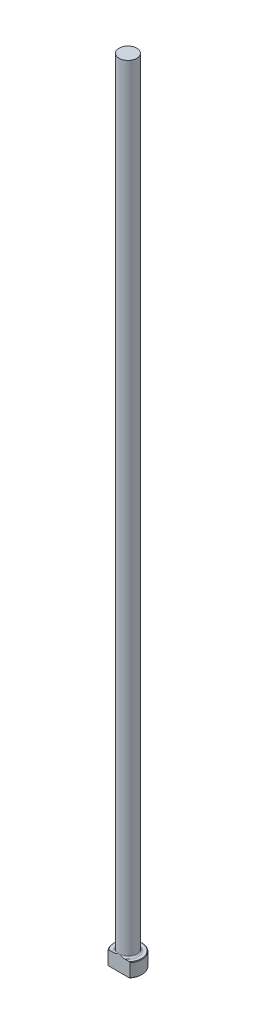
SolidWorks part; units mm, degrees
ref_plane "Front Plane" through (0, 0, 0) normal (0, 0, 1) x (1, 0, 0)
ref_plane "Top Plane" through (0, 0, 0) normal (0, 1, 0) x (1, 0, 0)
ref_plane "Right Plane" through (0, 0, 0) normal (1, 0, 0) x (0, 0, -1)
sketch "Sketch1" plane through (0, 0, 0) normal (0, 0, 1) x (1, 0, 0)
  line L0 (0, 259.9588) -> (0, -15.1925) construction
  line L1 (0, 0) -> (-6.35, 0)
  line L2 (-6.35, 0) -> (-6.35, 6.35)
  line L3 (-6.35, 6.35) -> (-3.9687, 6.35)
  line L4 (-3.9687, 6.35) -> (-3.9687, 355.6)
  line L5 (-3.9687, 355.6) -> (0, 355.6)
  line L6 (0, 355.6) -> (0, 0)
  dimension "L" = 355.6
  dimension "H" = 12.7
  dimension "T" = 6.35
  dimension "D" = 7.9375
revolve "Revolve1" add sketch "Sketch1" angle 360 about L0
chamfer "Chamfer1" distance 0.254 angle 45 2 edges at (0, 6.35, 6.35) (0, 0, 6.35)
fillet "Fillet1" radius 0.762 1 edges at (0, 6.35, 3.9687)
sketch "Sketch2" plane through (0, 0, 0) normal (0, 1, 0) x (1, 0, 0)
  line L0 (-4.957, -3.9687) -> (4.957, -3.9687)
  circle A0 centre (0, 0) radius 6.35 construction
  arc A1 (-4.957, -3.9687) -> (4.957, -3.9687) centre (0, 0) ccw
  circle A3 centre (0, 0) radius 3.9687 construction
  dimension "D1" = 0
extrude "Key" cut sketch "Sketch2" along normal through all
sketch "Pocket Sketch" plane through (0, 0, 0) normal (0, 0, 1) x (1, 0, 0)
  line L0 (-6.7469, 0) -> (-6.7469, 6.3754)
  line L1 (-6.7469, 6.3754) -> (-5.1276, 6.3754)
  line L2 (-4.3656, 7.1374) -> (-4.3656, 22.225)
  line L3 (-4.3656, 22.225) -> (0, 22.225)
  line L4 (0, 22.225) -> (0, 0)
  line L5 (0, 0) -> (-6.7469, 0)
  line L6 (0, 12.6104) -> (0, -2.4989) construction
  line L7 (-6.35, 6.096) -> (-6.35, 0.254) construction
  line L8 (6.096, 6.35) -> (-6.096, 6.35) construction
  line L9 (-3.9687, 355.6) -> (-3.9687, 7.112) construction
  line L10 (-5.1276, 6.3754) -> (-4.3656, 7.1374)
  point P3 (-4.3656, 6.3754)
  dimension "D1" = 13.4937
  dimension "D2" = 0.3969
  dimension "D3" = 0.0254
  dimension "D4" = 0.3969
  dimension "D5" = 8.7312
  dimension "D6" = 22.225
